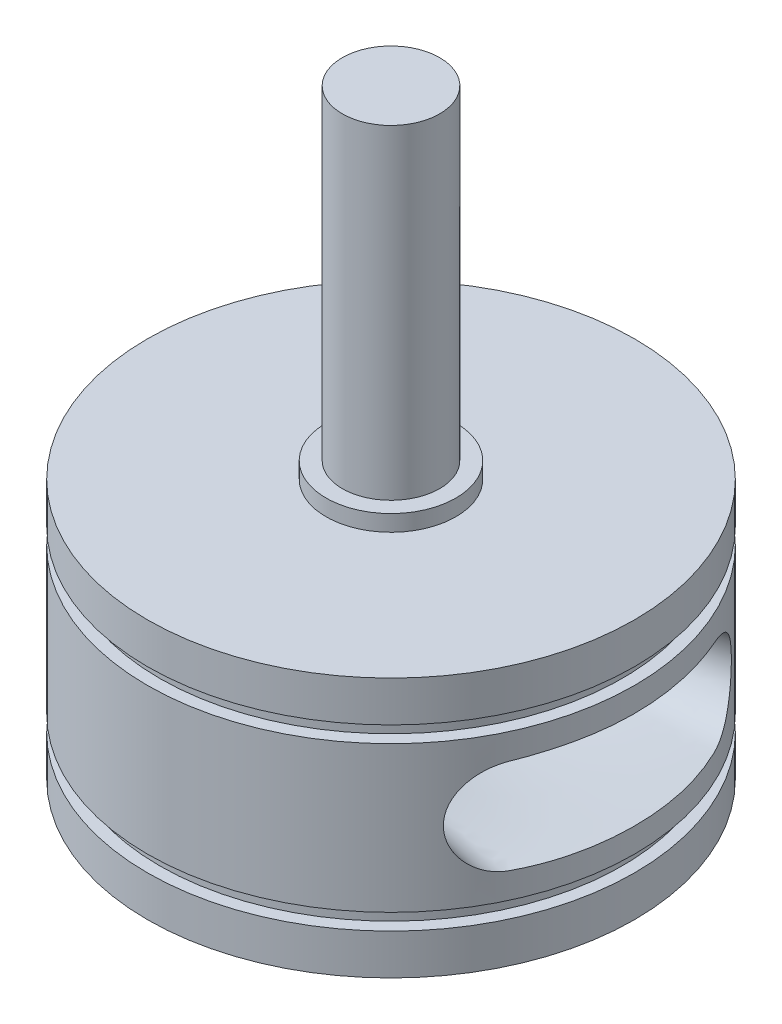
SolidWorks part; units mm, degrees
ref_plane "Plano frontal" through (0, 0, 0) normal (0, 0, 1) x (1, 0, 0)
ref_plane "Plano superior" through (0, 0, 0) normal (0, 1, 0) x (1, 0, 0)
ref_plane "Plano direito" through (0, 0, 0) normal (1, 0, 0) x (0, 0, -1)
sketch "Esboço1" plane through (0, 0, 0) normal (0, 0, 1) x (1, 0, 0)
  line L0 (0, 0) -> (0, 74.4448) construction
  line L1 (0, 0) -> (37.3667, 0) construction
  line L2 (0, 29) -> (3, 29)
  line L3 (3, 29) -> (3, 9)
  line L4 (3, 9) -> (4, 9)
  line L5 (4, 9) -> (4, 8)
  line L6 (4, 8) -> (15, 8)
  line L7 (15, 8) -> (15, 5.5)
  line L8 (15, 5.5) -> (14.25, 5.5)
  line L9 (14.25, 5.5) -> (14.25, 4.5)
  line L10 (14.25, 4.5) -> (15, 4.5)
  line L11 (15, 4.5) -> (15, -4.5)
  line L12 (0, 29) -> (0, 0)
  line L13 (14.25, -4.5) -> (15, -4.5)
  line L14 (14.25, -5.5) -> (14.25, -4.5)
  line L15 (15, -5.5) -> (14.25, -5.5)
  line L16 (15, -8) -> (15, -5.5)
  line L17 (4, -8) -> (15, -8)
  line L18 (4, -9) -> (4, -8)
  line L19 (3, -9) -> (4, -9)
  line L20 (3, -9) -> (3, -12)
  line L21 (3, -12) -> (0, -12)
  line L22 (0, -12) -> (0, 0)
  point P16 (15, 0)
  dimension "D1" = 16
  dimension "D2" = 1
  dimension "D3" = 0.75
  dimension "D4" = 2.5
  dimension "D5" = 30
  dimension "D6" = 1
  dimension "D7" = 8
  dimension "D8" = 6
  dimension "D9" = 3
  dimension "D10" = 20
revolve "Revolução1" add sketch "Esboço1" angle 360 about L0
ref_plane "Plano1" through (-15, 0, 0) normal (-1, 0, 0) x (0, 0, 1)
ref_plane "Plano2" through (15, 0, 0) normal (1, 0, 0) x (0, 0, -1)
sketch "Esboço4" plane through (-15, 0, 0) normal (-1, 0, 0) x (0, 0, 1)
  circle A0 centre (0, 0) radius 3
  dimension "D1" = 6
sketch "Esboço5" plane through (15, 0, 0) normal (1, 0, 0) x (0, 0, -1)
  line L0 (-6.5, 0) -> (6.5, 0) construction
  line L1 (-6.5, 3) -> (6.5, 3)
  line L2 (-6.5, -3) -> (6.5, -3)
  arc A0 (-6.5, 3) -> (-6.5, -3) centre (-6.5, 0) ccw
  arc A1 (6.5, -3) -> (6.5, 3) centre (6.5, 0) ccw
  circle A3 centre (0, 0) radius 3 construction
  point P3 (0, 0)
  dimension "D1" = 13
loft "Loft de corte1" cut profiles "Esboço5", "Esboço4"
